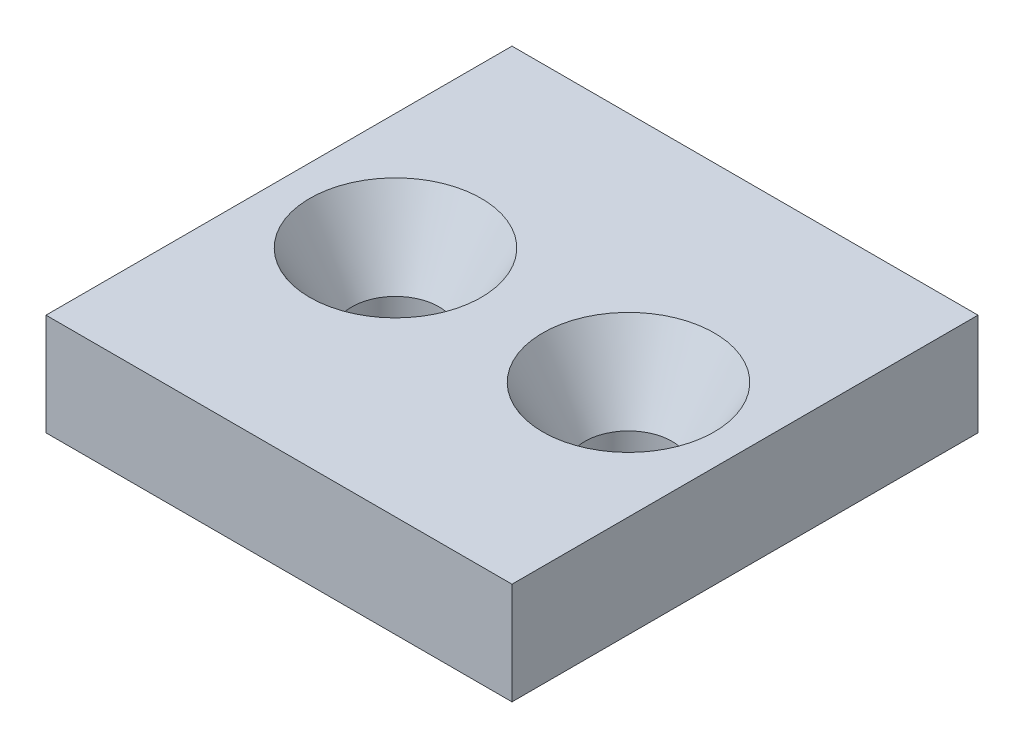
SolidWorks part; units mm, degrees
ref_plane "Front Plane" through (0, 0, 0) normal (0, 0, 1) x (1, 0, 0)
ref_plane "Top Plane" through (0, 0, 0) normal (0, 1, 0) x (1, 0, 0)
ref_plane "Right Plane" through (0, 0, 0) normal (1, 0, 0) x (0, 0, -1)
sketch "Sketch1" plane through (0, 0, 0) normal (0, 1, 0) x (1, 0, 0)
  line L1 (-16, -16) -> (16, -16)
  line L2 (-16, -16) -> (-16, 16)
  line L3 (-16, 16) -> (16, 16)
  line L4 (16, -16) -> (16, 16)
  line L5 (-16, -16) -> (16, 16) construction
  line L6 (-16, 16) -> (16, -16) construction
  point P0 (0, 0)
  dimension "D1" = 32
extrude "Boss-Extrude1" add sketch "Sketch1" along normal blind 7
hole_wizard "CSK for M6 Flat Head Machine Screw1" positions "Sketch3" profile "Sketch2" countersink size "M6" standard "ANSI Metric"
sketch "Sketch3" plane through (0, 7, 0) normal (0, 1, 0) x (-1, 0, 0)
  line L0 (-16, 16) -> (-16, -16) construction
  point P0 (8, 0)
  point P1 (-8, 0)
  dimension "D1" = 8
  dimension "D2" = 16
sketch "Sketch2" plane through (-8, 7, 0) normal (1, 0, 0) x (0, 0, 1)
  line L0 (0, 0) -> (0, 7)
  line L1 (0, 7) -> (3, 7)
  line L2 (3, 7) -> (3, 5.0056)
  line L3 (3, 5.0056) -> (5.89, 0)
  line L5 (5.89, 0) -> (0, 0)
  line L6 (-3, 5.0056) -> (-5.89, 0) construction
  line L11 (0, -6.35) -> (0, 107.95) construction
  dimension "Thru Hole Dia." = 6
  dimension "Thru Hole Depth" = 7
  dimension "Near C'Sink Dia." = 11.78
  dimension "Near C'Sink Angle" = 60
